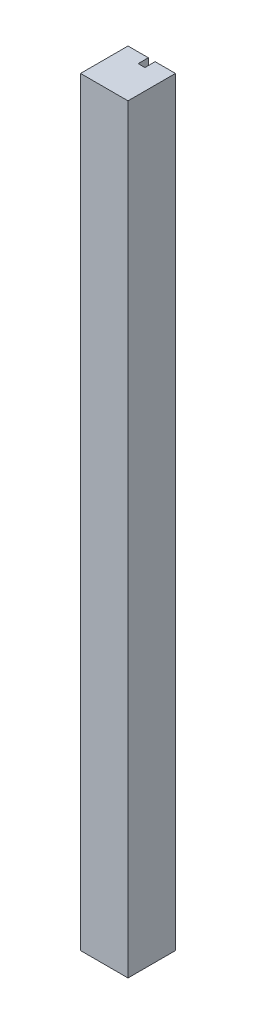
SolidWorks part; units mm, degrees
ref_plane "Front Plane" through (0, 0, 0) normal (0, 0, 1) x (1, 0, 0)
ref_plane "Top Plane" through (0, 0, 0) normal (0, 1, 0) x (1, 0, 0)
ref_plane "Right Plane" through (0, 0, 0) normal (1, 0, 0) x (0, 0, -1)
sketch "Sketch1" plane through (0, 0, 0) normal (0, 1, 0) x (1, 0, 0)
  line L1 (-44.45, 44.45) -> (44.45, 44.45)
  line L2 (-44.45, 44.45) -> (-44.45, -44.45)
  line L3 (-44.45, -44.45) -> (44.45, -44.45)
  line L4 (44.45, 44.45) -> (44.45, -44.45)
  line L5 (-44.45, 44.45) -> (44.45, -44.45) construction
  line L6 (-44.45, -44.45) -> (44.45, 44.45) construction
  line L7 (-6.35, 44.45) -> (6.35, 44.45)
  line L8 (-6.35, 44.45) -> (-6.35, 25.4)
  line L9 (-6.35, 25.4) -> (6.35, 25.4)
  line L10 (6.35, 44.45) -> (6.35, 25.4)
  point P0 (0, 0)
  dimension "D1" = 88.9
  dimension "D2" = 88.9
  dimension "D3" = 12.7
  dimension "D4" = 19.05
  dimension "D5" = 38.1
extrude "Boss-Extrude1" add sketch "Sketch1" along normal blind 1422.4 contours L1 L10 L9 L8 L2 L3 L4
